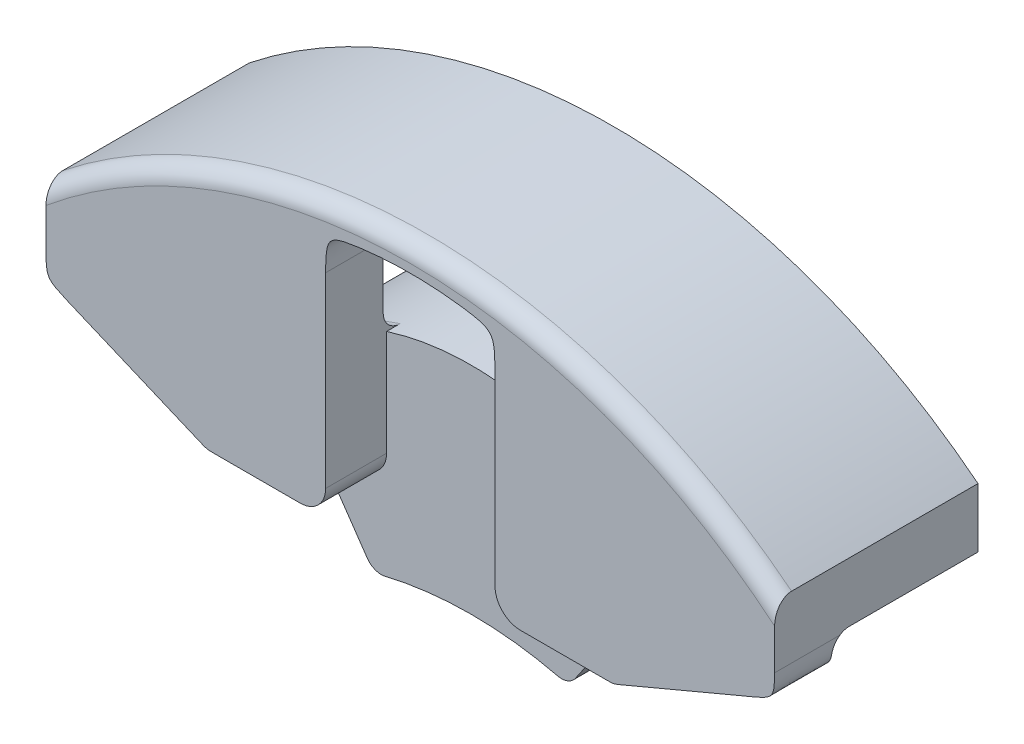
SolidWorks part; units mm, degrees
ref_plane "Plan de face" through (0, 0, 0) normal (0, 0, 1) x (1, 0, 0)
ref_plane "Plan de dessus" through (0, 0, 0) normal (0, 1, 0) x (1, 0, 0)
ref_plane "Plan de droite" through (0, 0, 0) normal (1, 0, 0) x (0, 0, -1)
sketch "Esquisse1" plane through (0, 0, 0) normal (0, 0, 1) x (1, 0, 0)
  line L0 (-5, 0) -> (5, 0)
  line L2 (-21.5, 9) -> (-21.5, 4)
  line L3 (-12, 0) -> (12, 0)
  line L4 (21.5, 9) -> (21.5, 4)
  line L6 (-5, 14.4499) -> (-5, 0)
  line L8 (5, 14.4499) -> (5, 0)
  line L9 (21.5, 4) -> (12, 0)
  line L10 (-12, 0) -> (-21.5, 4)
  line L11 (0, 0) -> (0, 16.5) construction
  arc A0 (-21.5, 9) -> (21.5, 9) centre (0, -18.0667) cw
  arc A1 (5, 14.4499) -> (-5, 14.4499) centre (0, -8) ccw
  point P2 (0, 16.5)
  point P17 (0, 15)
  dimension "D1" = 16.5
  dimension "D5" = 10
  dimension "D4" = 23
  dimension "D2" = 43
  dimension "D3" = 7.5
  dimension "D6" = 5
  dimension "D7" = 7
  dimension "D8" = 7
  dimension "D9" = 1.5
extrude "Boss.-Extru.1" add sketch "Esquisse1" along normal blind 12 contours L0 L8 A1 L6 | L2 L10 L3 L9 L4 A0
ref_plane "Plan1" through (0, 0, 8.4) normal (0, 0, 1) x (1, 0, 0)
fillet "Congé1" radius 1.5 2 edges at (-5, 0, 6) (5, 0, 6)
fillet "Congé2" radius 2 4 edges at (21.5, 4, 6) (12, 0, 6) (-12, 0, 6) (-21.5, 4, 6)
sketch "Esquisse3" plane through (0, 0, 0) normal (0, 0, -1) x (-1, 0, 0)
  line L0 (-20.2761, 3.4847) -> (-12.3722, 0.1567) construction
  line L1 (22.5, 0) -> (12, 0)
  line L2 (-22.5, 5.302) -> (-22.5, 0)
  line L3 (-21.5, 9) -> (-21.5, 5.328) construction
  line L8 (0, 15.8199) -> (0, -5.0515) construction
  line L9 (-22.5, 0) -> (-12, 0)
  line L10 (22.5, 5.302) -> (22.5, 0)
  line L11 (-6.5, 0) -> (-11.5961, 0) construction
  line L13 (-12, 0) -> (-11.1572, 3.6505)
  line L14 (12, 0) -> (11.1572, 3.6505)
  arc A2 (15.858, 8.6591) -> (-15.9874, 8.5349) centre (0, -8) ccw construction
  arc A3 (5, 14.4499) -> (-5, 14.4499) centre (0, -8) ccw construction
  arc A4 (15.9874, 8.5349) -> (-15.9874, 8.5349) centre (0, -8) ccw
  arc A5 (10.4786, 4.7455) -> (-10.4786, 4.7455) centre (0, -8) ccw
  arc A6 (11.3764, 3.9511) -> (-11.4692, 3.862) centre (0, -8) ccw construction
  arc A7 (10.4786, 4.7455) -> (11.1572, 3.6505) centre (9.2085, 3.2006) cw
  arc A8 (-10.4786, 4.7455) -> (-11.1572, 3.6505) centre (-9.2085, 3.2006) ccw
  arc A10 (-15.9874, 8.5349) -> (-22.5, 5.302) centre (-24.3286, 17.1619) cw
  arc A11 (15.9874, 8.5349) -> (22.5, 5.302) centre (24.3286, 17.1619) ccw
  point P0 (-21.5, 5.5)
  point P30 (0, 8.5)
  point P35 (11.0096, 4.2898)
  dimension "D1" = 6.5
  dimension "D3" = 3.5
  dimension "D4" = 2
  dimension "D5" = 12
  dimension "D6" = 1
  dimension "D2" = 77
extrude "Enlèv. mat.-Extru.4" cut sketch "Esquisse3" against normal offset from surface (8.6 mm away) 3.4
sketch "Esquisse2" plane through (0, 0, 8.4) normal (0, 0, 1) x (1, 0, 0)
  line L0 (6.5, 0) -> (11.5961, 0) construction
  line L1 (5, 14.4499) -> (5, 1.5) construction
  line L2 (-5, 14.4499) -> (-5, 1.5) construction
  line L3 (-11.5961, 0) -> (-6.5, 0) construction
  line L4 (6.5, 0) -> (8.5, 0)
  line L5 (5, 7.7242) -> (5, 1.5)
  line L6 (-5, 7.7242) -> (-5, 1.5)
  line L7 (-8.5, 0) -> (-6.5, 0)
  line L8 (-8.5, 0) -> (-8.5, -1)
  line L9 (-8.5, -1) -> (-5.75, -5)
  line L10 (8.5, 0) -> (8.5, -1)
  line L11 (8.5, -1) -> (5.75, -5)
  line L12 (21.5, 9) -> (21.5, 5.328) construction
  line L13 (-21.5, 9) -> (-21.5, 5.328) construction
  arc A0 (5, 1.5) -> (6.5, 0) centre (6.5, 1.5) ccw construction
  arc A1 (-6.5, 0) -> (-5, 1.5) centre (-6.5, 1.5) ccw construction
  arc A2 (5, 1.5) -> (6.5, 0) centre (6.5, 1.5) ccw
  arc A3 (-6.5, 0) -> (-5, 1.5) centre (-6.5, 1.5) ccw
  arc A4 (-5.75, -5) -> (5.75, -5) centre (0, -26.2353) cw
  arc A5 (5, 14.4499) -> (-5, 14.4499) centre (0, -8) ccw construction
  arc A6 (10.4786, 4.7455) -> (5, 7.7242) centre (0, -8) ccw construction
  arc A7 (5, 7.7242) -> (-5, 7.7242) centre (0, -8) ccw
  point P22 (0, -4.2353)
  point P29 (0, 15)
  dimension "D3" = 22
  dimension "D1" = 13
  dimension "D2" = 13
  dimension "D4" = 20
  dimension "D5" = 1
  dimension "D6" = 11.5
extrude "Boss.-Extru.2" add sketch "Esquisse2" against normal blind 4.6
fillet "Congé3" radius 2.3 2 edges at (5, 14.4499, 10.3) (-5, 14.4499, 10.3)
fillet "Congé4" radius 1 15 edges at (7.8813, 6.496, 8.6) (10.9085, 4.2542, 8.6) (18.5412, 6.6497, 8.6) (-7.8813, 6.496, 8.6) (-10.9085, 4.2542, 8.6) (11.5759, 1.837, 8.6) (-11.5759, 1.837, 8.6) (-18.5412, 6.6497, 8.6) (-5.75, -5, 6.1) (5.75, -5, 6.1) (8.5, -1, 6.1) (-8.5, -1, 6.1) (0, 16.5, 12)
